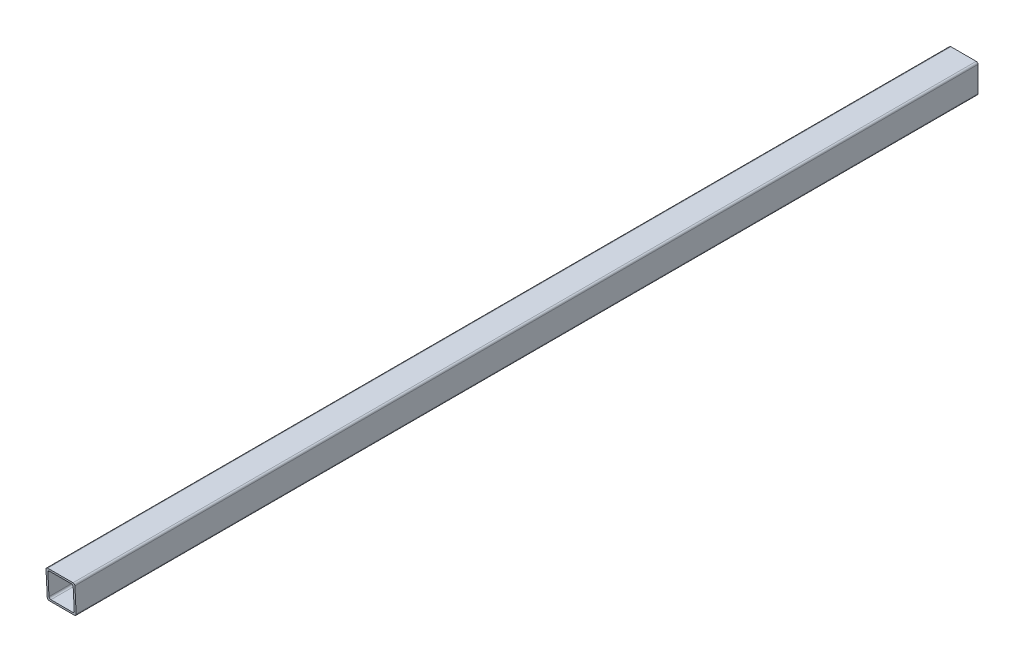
SolidWorks part; units mm, degrees
other "Objet de détail1"
ref_plane "Plan de face" through (0, 0, 0) normal (0, 0, 1) x (1, 0, 0)
ref_plane "Plan de dessus" through (0, 0, 0) normal (0, 1, 0) x (1, 0, 0)
ref_plane "Plan de droite" through (0, 0, 0) normal (1, 0, 0) x (0, 0, -1)
sketch "Esquisse1" plane through (0, 0, 0) normal (0, 0, 1) x (1, 0, 0)
  line L1 (-40, 40) -> (40, 40)
  line L2 (-40, 40) -> (-40, -40)
  line L3 (-40, -40) -> (40, -40)
  line L4 (40, 40) -> (40, -40)
  line L5 (-35, 35) -> (35, 35)
  line L6 (-35, 35) -> (-35, -35)
  line L7 (-35, -35) -> (35, -35)
  line L8 (35, 35) -> (35, -35)
  dimension "D1" = 80
  dimension "D2" = 80
  dimension "D3" = 40
  dimension "D4" = 40
  dimension "D5" = 5
  dimension "D6" = 5
  dimension "D7" = 5
  dimension "D8" = 5
extrude "Boss.-Extru.1" add sketch "Esquisse1" along normal blind 3000
sketch "Esquisse2" plane through (40, 0, 0) normal (1, 0, 0) x (0, 0, -1)
  line L0 (-2496, 393.8687) -> (-2496, -554.66) construction
  line L1 (0, -40) -> (0, 40) construction
  line L2 (-2496, -40) -> (-2502.4229, 88.4573)
  line L3 (-3000, -40) -> (0, -40) construction
  line L4 (-2502.4229, 88.4573) -> (-2684.3003, 85.6055)
  line L5 (-2496, -40) -> (-3008.6823, -78.399)
  line L6 (-3008.6823, -78.399) -> (-3003.8149, 85.6055)
  line L7 (-3003.8149, 85.6055) -> (-2684.3003, 85.6055)
  dimension "D1" = 2496
  dimension "D2" = 2.862
extrude "Enlèv. mat.-Extru.1" cut sketch "Esquisse2" against normal through all
fillet "Congé1" radius 5 8 edges at (40, -40, 1248) (35, -35, 1248.125) (-40, -40, 1248) (-35, -35, 1248.125) (35, 35, 1249.875) (40, 40, 1250) (-35, 35, 1249.875) (-40, 40, 1250)
